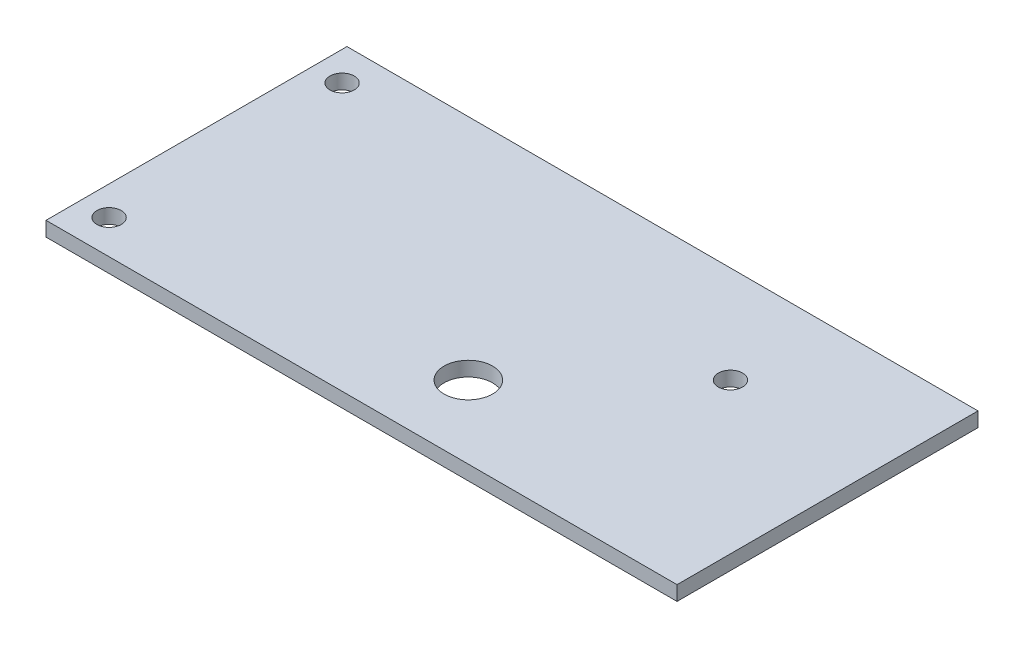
SolidWorks part; units mm, degrees
ref_plane "Front Plane" through (0, 0, 0) normal (0, 0, 1) x (1, 0, 0)
ref_plane "Top Plane" through (0, 0, 0) normal (0, 1, 0) x (1, 0, 0)
ref_plane "Right Plane" through (0, 0, 0) normal (1, 0, 0) x (0, 0, -1)
sketch "Sketch1" plane through (0, 0, 0) normal (0, 1, 0) x (1, 0, 0)
  line L1 (0, 0) -> (130, 0)
  line L2 (0, 0) -> (0, 62)
  line L3 (0, 62) -> (130, 62)
  line L4 (130, 0) -> (130, 62)
  circle A0 centre (72, 15) radius 5
  dimension "D1" = 58
  dimension "D2" = 15
  dimension "D3" = 10
  dimension "D4" = 130
  dimension "D5" = 62
extrude "Extrude1" add sketch "Sketch1" along normal blind 3
sketch "Sketch2" plane through (0, 3, 0) normal (0, 1, 0) x (1, 0, 0)
  line L0 (6, 0) -> (6, 62) construction
  line L1 (0, 0) -> (130, 0) construction
  line L2 (130, 62) -> (0, 62) construction
  line L3 (0, 62) -> (0, 0) construction
  line L4 (130, 0) -> (130, 62) construction
  point P6 (6, 55)
  point P7 (6, 7)
  point P8 (99, 42)
  dimension "D1" = 6
  dimension "D2" = 7
  dimension "D3" = 7
  dimension "D4" = 31
  dimension "D5" = 20
hole_wizard "M6 Tapped Hole1" positions "3DSketch1" profile "Sketch4" tap size "M6" standard "ISO"
sketch3d "3DSketch1"
  point P0 (6, 3, -55)
  point P3 (6, 3, -7)
  point P6 (99, 3, -42)
sketch "Sketch4" plane through (6, 3, -55) normal (1, 0, 0) x (0, 0, 1)
  line L0 (0, 0) -> (0, 3)
  line L1 (0, 3) -> (2.5, 3)
  line L2 (2.5, 3) -> (2.5, 0)
  line L5 (2.5, 0) -> (0, 0)
  line L11 (0, -6.35) -> (0, 107.95) construction
  dimension "Thru Tap Drill Dia." = 5
  dimension "Thru Tap Drill Depth" = 3
